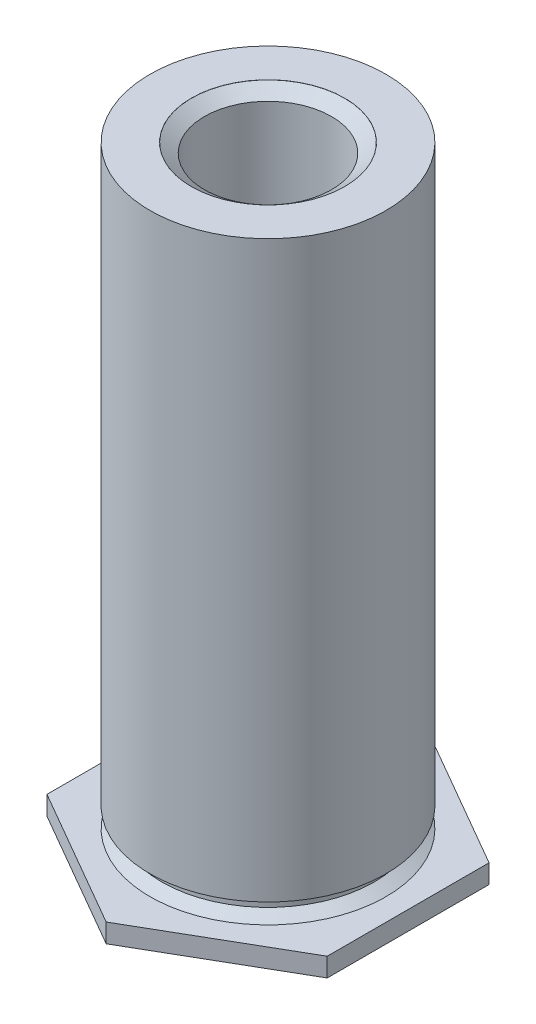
SolidWorks part; units mm, degrees
ref_plane "Plane1" through (0, 0, 0) normal (0, 0, 1) x (1, 0, 0)
ref_plane "Plane2" through (0, 0, 0) normal (0, 1, 0) x (1, 0, 0)
ref_plane "Plane3" through (0, 0, 0) normal (1, 0, 0) x (0, 0, -1)
sketch "BodySke" plane through (0, 0, 0) normal (0, 0, 1) x (1, 0, 0)
  line L0 (2.695, 0) -> (3.712, 0)
  line L1 (3.712, 0) -> (3.712, 0.4312)
  line L2 (3.712, 0.4312) -> (2.695, 0.4312)
  line L3 (1.45, 14) -> (1.45, 7)
  line L4 (2.695, 0.884) -> (2.4255, 0.884)
  line L5 (2.4255, 0.884) -> (2.4255, 0.5868)
  line L6 (2.695, 0.0025) -> (2.695, 0)
  line L7 (1.016, 13.4) -> (3.6522, 13.4) construction
  line L8 (2.695, 14) -> (1.45, 14)
  line L9 (0, 0) -> (0, 15.24) construction
  line L10 (2.695, 0.0025) -> (0, 0.0025)
  line L11 (2.695, 14) -> (2.695, 0.884)
  line L12 (0, 7) -> (1.45, 7)
  line L13 (0, 7) -> (0, 0.0025)
  line L14 (1.016, 7) -> (3.6522, 7) construction
  line L15 (1.016, 13.9975) -> (3.6522, 13.9975) construction
  line L16 (2.695, 0.4312) -> (2.4255, 0.5868)
  dimension "D1" = 0.0025
  dimension "E_dia" = 7.424
  dimension "D2" = 30
  dimension "C_dia" = 5.39
  dimension "Thread_min" = 2.9
  dimension "Clinching_ht" = 0.4312
  dimension "Advance" = 0.6
  dimension "Length" = 14
  dimension "Thread_limit" = 7
  dimension "Thread_depth" = 7
  dimension "Drill_depth" = 0.0025
  dimension "Groove_wid" = 0.4528
  dimension "Groove_dia" = 4.851
revolve "Body" add sketch "BodySke"
revolve "EndChamfer" cut sketch "EndChamferSke" angle 360 about L0
sketch "EndChamferSke" plane through (0, 0, 0) normal (0, 0, 1) x (1, 0, 0)
  line L0 (0, -2.54) -> (0, 7.62) construction
  line L1 (0, 0) -> (0, 15.24) construction
  line L2 (1.7515, 13.9975) -> (1.7515, 14.254)
  line L4 (1.7515, 13.9975) -> (1.75, 13.9975)
  line L6 (1.75, 13.9975) -> (1.45, 13.7875)
  line L8 (1.45, 13.7875) -> (1.45, 14.254)
  line L9 (1.7515, 14.254) -> (1.45, 14.254)
  line L10 (2.695, 14) -> (-2.695, 14) construction
  dimension "D1" = 0.254
  dimension "Thread_nominal" = 3.5
  dimension "D2" = 34.99
  dimension "Thread_min" = 2.9
  dimension "Inset" = 0.0025
  dimension "B_dia" = 3.503
revolve "TapDrill" cut sketch "TapDriSke" angle 360 about L0
sketch "TapDriSke" plane through (0, 0, 0) normal (0, 0, 1) x (1, 0, 0)
  line L0 (0, 0) -> (0, 15.24) construction
  line L1 (0, 0) -> (0, 15.24) construction
  line L2 (1.45, 4) -> (1.45, 14)
  line L3 (2.695, 14) -> (-2.695, 14) construction
  line L4 (1.45, 4) -> (0, 3.3994)
  line L5 (0, 3.3994) -> (0, 14)
  line L6 (0, 14) -> (1.45, 14)
  line L7 (1.45, 7) -> (1.45, 14) construction
  line L8 (0, 3.3994) -> (-1.45, 4) construction
  line L9 (-1.45, 14) -> (-1.45, 7) construction
  dimension "D1" = 135
  dimension "Depth" = 10
ref_plane "Plane4" through (0, -0.5486, 0) normal (0, 1, 0) x (-1, 0, 0)
sketch "ThdSchSke" plane through (0, 0, 0) normal (0, 0, 1) x (1, 0, 0)
  line L0 (0, -5.08) -> (0, 7.62) construction
  line L1 (0, 0) -> (0, 15.24) construction
  line L2 (0, 13.9975) -> (1.75, 13.9975) construction
  line L4 (1.75, 13.9975) -> (1.45, 14.2075)
  line L5 (1.7515, 13.9975) -> (-1.7515, 13.9975) construction
  line L6 (1.75, 13.9975) -> (1.45, 13.7874)
  line L7 (1.45, 14.2075) -> (1.45, 13.7874)
  dimension "Vee_angle" = 70
  dimension "Thread_nominal" = 3.5
  dimension "Thread_min" = 2.9
revolve "ThreadSchematic" [suppressed] cut sketch "ThdSchSke" angle 360 about L0
pattern_linear "ThdSchPat" [suppressed]
sketch "HexDieSke" plane through (0, 0.4312, 0) normal (0, 1, 0) x (-1, 0, 0)
  line L0 (0, 3.695) -> (3.2, 1.8475)
  line L1 (3.2, 1.8475) -> (3.2, -1.8475)
  line L2 (3.2, -1.8475) -> (0, -3.695)
  line L3 (0, -3.695) -> (-3.2, -1.8475)
  line L4 (-3.2, -1.8475) -> (-3.2, 1.8475)
  line L5 (-3.2, 1.8475) -> (0, 3.695)
  circle A1 centre (0, 0) radius 3.2 construction
  circle A2 centre (0, 0) radius 3.695 construction
  circle A3 centre (0, 0) radius 3.7125
  dimension "Width_across_flats" = 6.4
  dimension "OD" = 7.425
extrude "HexDie" cut sketch "HexDieSke" against normal blind 0.4312
equation "' \"Length@BodySke\" = 14"
equation "' \"C_dia@BodySke\" = 5.39"
equation "' \"Thread_depth@BodySke\" = 7 'always explicit"
equation "' \"Drill_depth@BodySke\" = 0.001 'implicit, or explicit"
equation "' \"Width_across_flats@HexDieSke\" = 6.4"
equation "' \"Advance@BodySke\" = 0.6"
equation "' \"Thread_min@BodySke\" = 2.9"
equation "' \"Thread_nominal@ThreadCosmetic\" = 3.5"
equation "\"B_dia@EndChamferSke\" = \"Thread_nominal@ThreadCosmetic\" + 0.003"
equation "\"E_dia@BodySke\" = \"Width_across_flats@HexDieSke\" * 1.16"
equation "\"Clinching_ht@BodySke\" = \"C_dia@BodySke\" * 0.08"
equation "\"Groove_dia@BodySke\" = \"C_dia@BodySke\" * 0.9"
equation "\"Groove_wid@BodySke\" = \"Clinching_ht@BodySke\" * 1.05"
equation "\"Thread_limit@BodySke\" = ((sgn( \"Length@BodySke\" - 0.006 - \"Thread_depth@BodySke\" )-1)*( \"Length@BodySke\" - 0.006 - \"Thread_depth@BodySke\" ))/-2+ \"Thread_depth@BodySke\""
equation "\"Depth@TapDriSke\" = \"Thread_limit@BodySke\" + \"Advance@BodySke\" * 5"
equation "\"Depth@TapDriSke\" = ((sgn( \"Depth@TapDriSke\" - \"Drill_depth@BodySke\" )+1)*( \"Depth@TapDriSke\" - \"Drill_depth@BodySke\" ))/2 +\"Drill_depth@BodySke\""
equation "\"Depth@HexDie\" = \"Clinching_ht@BodySke\""
equation "\"OD@HexDieSke\" =  \"Width_across_flats@HexDieSke\" * 1.16 + 0.001"
equation "\"Thread_nominal@EndChamferSke\" = \"Thread_nominal@ThreadCosmetic\""
equation "\"Thread_min@EndChamferSke\" = \"Thread_min@BodySke\""
equation "\"D2@EndChamferSke\" = \"Vee_angle@ThdSchSke\" / 2 - 0.01"
equation "\"Thread_nominal@ThdSchSke\" = \"Thread_nominal@ThreadCosmetic\""
equation "\"Thread_min@ThdSchSke\" = \"Thread_min@BodySke\""
equation "\"Num_threads@ThdSchPat\" = int(  ( \"Thread_limit@BodySke\" - \"Inset@EndChamferSke\" ) / \"Advance@BodySke\" + 0.999 )  + 1"
equation "\"Advance@ThdSchPat\" = (  \"Thread_limit@BodySke\" - \"Inset@EndChamferSke\" ) /  (\"Num_threads@ThdSchPat\" - 1) 'relax it"
